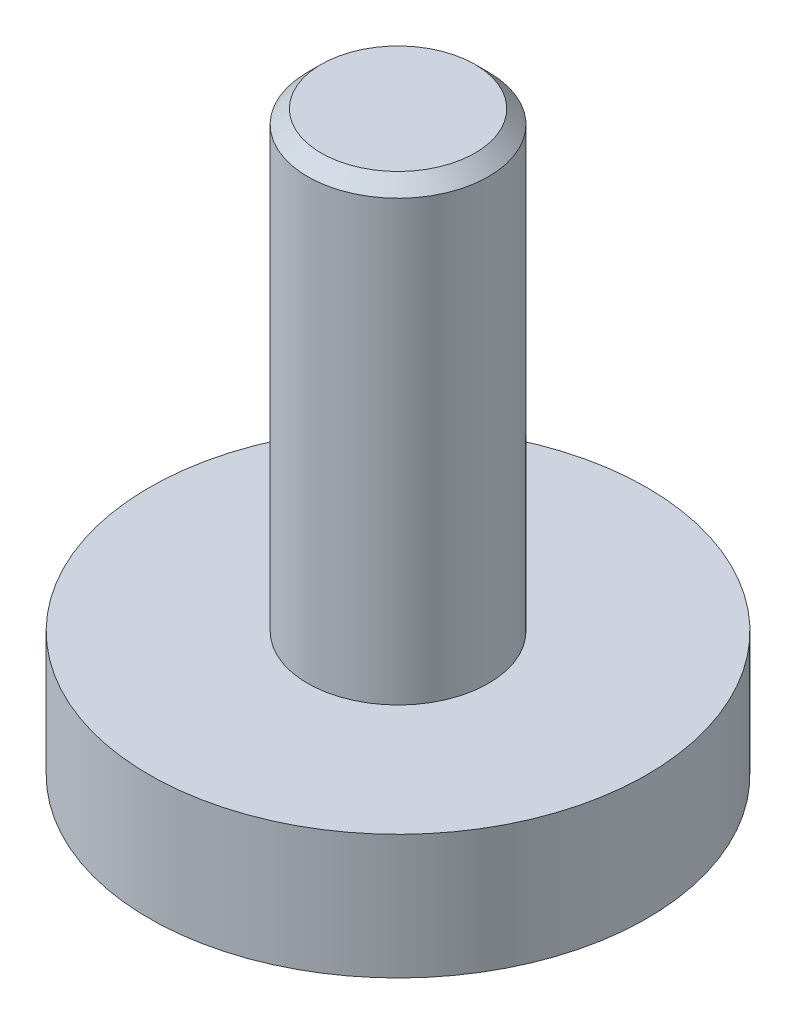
SolidWorks part; units mm, degrees
ref_plane "Plan de face" through (0, 0, 0) normal (0, 0, 1) x (1, 0, 0)
ref_plane "Plan de dessus" through (0, 0, 0) normal (0, 1, 0) x (1, 0, 0)
ref_plane "Plan de droite" through (0, 0, 0) normal (1, 0, 0) x (0, 0, -1)
sketch "Esquisse1" plane through (0, 0, 0) normal (0, 0, 1) x (1, 0, 0)
  line L0 (0, 20) -> (3.3991, 20)
  line L1 (3.3991, 20) -> (4, 19.3991)
  line L2 (4, 19.3991) -> (4, 0)
  line L3 (4, 0) -> (11, 0)
  line L4 (11, 0) -> (11, -5.5)
  line L5 (11, -5.5) -> (9.5, -5.5)
  line L6 (9.5, -5.5) -> (7.6, -3.6)
  line L7 (7.6, -3.6) -> (7.6, -5)
  line L8 (7.6, -5) -> (2.8875, -5)
  line L9 (2.8875, -5) -> (2.5, -4.6125)
  line L10 (2.5, -4.6125) -> (2.5, -1.5)
  line L11 (2.5, -1.5) -> (0, -0.0566)
  line L12 (0, -0.0566) -> (0, 20)
  line L13 (0, -5) -> (0, 20) construction
revolve "Révolution1" add sketch "Esquisse1" angle 360 about L13
sketch "Esquisse2" plane through (0, -5, 0) normal (0, -1, 0) x (1, 0, 0)
  line L0 (-2.5, 1.4434) -> (-2.5, -1.4434)
  line L1 (-2.5, -1.4434) -> (0, -2.8868)
  line L2 (0, -2.8868) -> (2.5, -1.4434)
  line L3 (2.5, -1.4434) -> (2.5, 1.4434)
  line L4 (2.5, 1.4434) -> (0, 2.8868)
  line L5 (0, 2.8868) -> (-2.5, 1.4434)
extrude "Enlèv. mat.-Extru.1" cut sketch "Esquisse2" against normal blind 3.5
